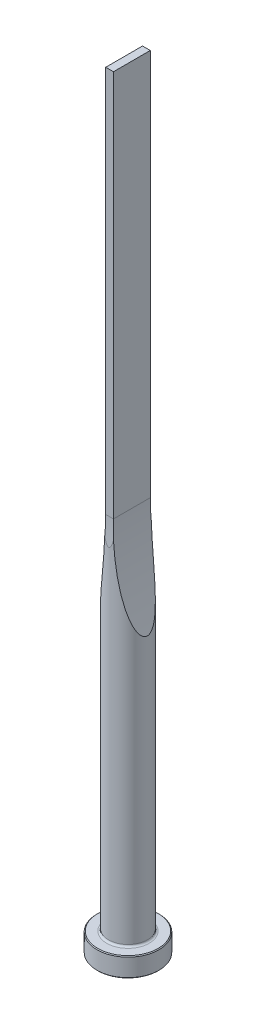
SolidWorks part; units mm, degrees
ref_plane "Front Plane" through (0, 0, 0) normal (0, 0, 1) x (1, 0, 0)
ref_plane "Top Plane" through (0, 0, 0) normal (0, 1, 0) x (1, 0, 0)
ref_plane "Right Plane" through (0, 0, 0) normal (1, 0, 0) x (0, 0, -1)
sketch "Sketch1" plane through (0, 0, 0) normal (0, 0, 1) x (1, 0, 0)
  line L0 (0, 0) -> (7.8, 0)
  line L1 (55, 0) -> (-55, 0) construction
  line L2 (8, 0.2) -> (8, 4.8)
  line L3 (7.8, 5) -> (5.5, 5)
  line L4 (5, 5.5) -> (5, 200)
  line L5 (0, 200) -> (5, 200)
  line L6 (8, 4.8) -> (7.8, 5)
  line L7 (7.8, 0) -> (8, 0.2)
  line L8 (0, 200) -> (0, 0)
  arc A0 (5, 5.5) -> (5.5, 5) centre (5.5, 5.5) ccw
  point P1 (8, 0)
  point P6 (8, 5)
  dimension "D4" = 0.5
  dimension "D1" = 5
  dimension "D2" = 8
  dimension "D3" = 5
  dimension "D5" = 200
revolve "Revolve1" add sketch "Sketch1" angle 360 about L8
sketch "Sketch2" plane through (0, 0, 0) normal (0, 0, 1) x (1, 0, 0)
  line L0 (1, 200) -> (1, 100)
  line L1 (5, 200) -> (-5, 200) construction
  line L2 (-1, 200) -> (-1, 100)
  line L3 (5, 200) -> (5, 73.467)
  line L4 (-5, 200) -> (-5, 73.467)
  line L5 (0, -8.8) -> (0, 8.8) construction
  line L6 (5, 200) -> (1, 200)
  line L8 (-1, 200) -> (-5, 200)
  arc A0 (1, 100) -> (5, 73.467) centre (91, 100) ccw
  arc A1 (-1, 100) -> (-5, 73.467) centre (-91, 100) cw
  dimension "D4" = 90
  dimension "D1" = 100
  dimension "D2" = 2
  dimension "D3" = 1
extrude "Cut-Extrude1" cut sketch "Sketch2" against normal mid plane 10
sketch "Sketch3" plane through (0, 0, 0) normal (1, 0, 0) x (0, 0, -1)
  line L0 (4.75, 200) -> (4.75, 100)
  line L1 (-4.899, 200) -> (4.899, 200) construction
  line L2 (-4.75, 200) -> (-4.75, 100)
  line L3 (5, 200) -> (5, 93.2965)
  line L4 (4.75, 200) -> (5, 200)
  line L5 (0, 8.8) -> (0, -8.8) construction
  line L6 (-5, 200) -> (-5, 93.2965)
  line L8 (-4.75, 200) -> (-5, 200)
  arc A0 (4.75, 100) -> (5, 93.2965) centre (94.75, 100) ccw
  arc A1 (-4.75, 100) -> (-5, 93.2965) centre (-94.75, 100) cw
  dimension "D2" = 90
  dimension "D1" = 100
  dimension "D3" = 9.5
  dimension "D4" = 4.75
extrude "Cut-Extrude2" cut sketch "Sketch3" against normal mid plane 10
